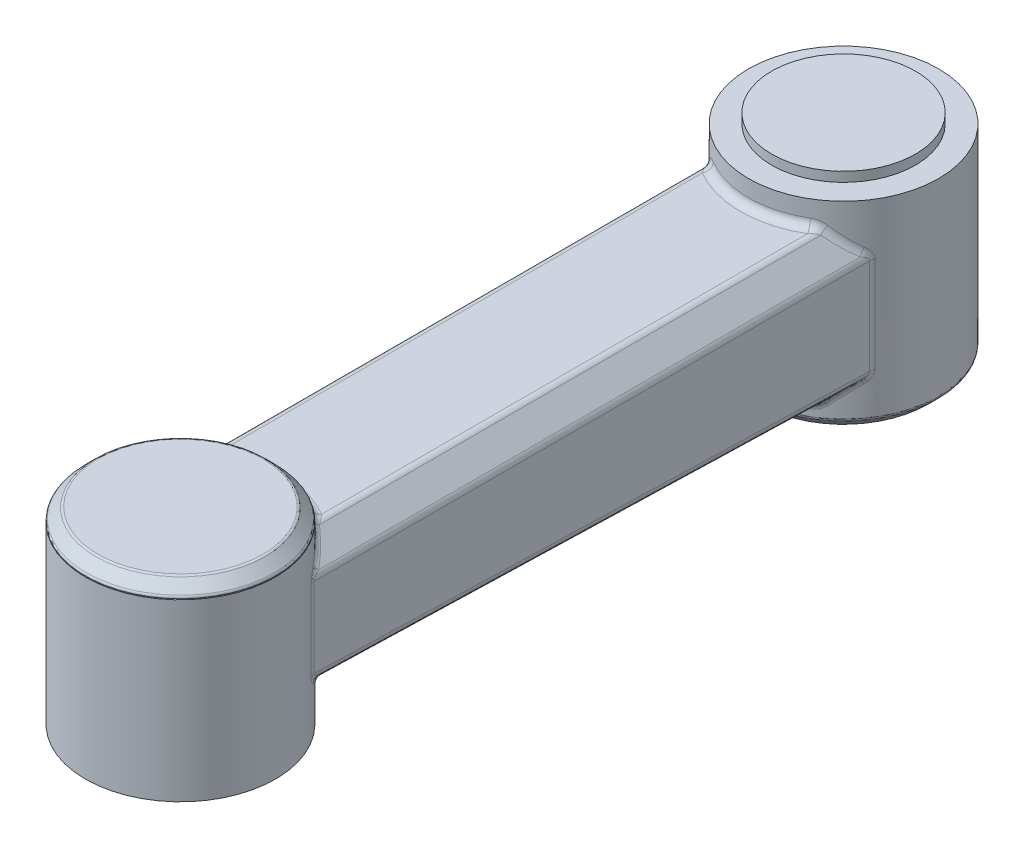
SolidWorks part; units mm, degrees
ref_plane "Ön Düzlem" through (0, 0, 0) normal (0, 0, 1) x (1, 0, 0)
ref_plane "Üst Düzlem" through (0, 0, 0) normal (0, 1, 0) x (1, 0, 0)
ref_plane "Sağ Düzlem" through (0, 0, 0) normal (1, 0, 0) x (0, 0, -1)
sketch "Çizim1" plane through (0, 0, 0) normal (1, 0, 0) x (0, 0, -1)
  line L1 (0, 0) -> (-59.5, 0)
  line L2 (0, 0) -> (0, 110)
  line L3 (0, 110) -> (-59.5, 110)
  line L4 (-59.5, 0) -> (-59.5, 110)
  line L5 (0, 0) -> (-45, 0)
  dimension "D1" = 59.5
  dimension "D2" = 110
revolve "Döndür1" add sketch "Çizim1" angle 360 about L2
sketch "Çizim2" plane through (0, 110, 0) normal (0, 1, 0) x (1, 0, 0)
  circle A0 centre (0, 0) radius 59.5
extrude "Yükseklik-Ekstrüzyon1" add sketch "Çizim2" along normal blind 8 separate body
chamfer "Pah1" distance 0.5 angle 45 1 edges at (0, 110, -59.5)
chamfer "Pah2" distance 7 angle 45 1 edges at (0, 118, 59.5)
fillet "Radyus1" radius 2 2 edges at (0, 111, 59.5) (0, 118, 52.5)
sketch "Çizim3" plane through (0, 0, 0) normal (0, 0, 1) x (1, 0, 0)
  line L0 (0, 110.1716) -> (0, 0) construction
  line L1 (-59.5, 110.1716) -> (59.5, 110.1716) construction
  line L3 (50, 7.5858) -> (-50, 7.5858)
  line L4 (50, 7.5858) -> (50, 102.5858)
  line L5 (50, 102.5858) -> (-50, 102.5858)
  line L6 (-50, 7.5858) -> (-50, 102.5858)
  line L7 (50, 7.5858) -> (-50, 102.5858) construction
  line L8 (50, 102.5858) -> (-50, 7.5858) construction
  point P5 (0, 55.0858)
  dimension "D1" = 95
  dimension "D2" = 100
ref_plane "Düzlem1" through (0, 0, 400) normal (0, 0, 1) x (1, 0, 0)
sketch "Çizim4" plane through (0, 0, 400) normal (0, 0, 1) x (1, 0, 0)
  line L0 (50, 7.5858) -> (-50, 102.5858) construction
  line L2 (50, 19.1687) -> (50, 102.5858)
  line L3 (50, 102.5858) -> (-50, 102.5858)
  line L4 (-50, 19.1687) -> (-50, 102.5858)
  line L5 (37.8075, 19.1687) -> (-50, 102.5858) construction
  line L6 (50, 102.5858) -> (-37.8075, 19.1687) construction
  line L7 (-50, 19.1687) -> (50, 19.1687)
  point P0 (0, 55.0858)
  dimension "D1" = 100
loft "Loft1" add profiles "Çizim4", "Çizim3"
ref_plane "Düzlem2" through (0, 0, 207.5) normal (0, 0, 1) x (1, 0, 0)
mirror "Aynalama1" about plane through (0, 0, 207.5) normal (0, 0, 1) of "Pah2", "Yükseklik-Ekstrüzyon1", "Döndür1", "Pah1", "Radyus1"
mirror "Aynalama3" about plane through (0, 0, 207.5) normal (0, 0, 1)
chamfer "Pah3" distance 15 angle 45 4 edges
fillet "Radyus2" radius 5 24 edges at (43.2339, 26.6566, 374.1211) (43.2339, 17.0069, 40.8789) (43.2339, 94.3519, 40.8789) (43.2339, 94.3519, 374.1211) (50, 87.5858, 207.5) (50, 55.5559, 32.2529) (50, 28.6007, 207.5) (50, 60.6306, 382.7471) (0, 17.8801, 355.5) (35, 13.5944, 207.5) (0, 9.3087, 59.5) (-35, 13.5944, 207.5) (-43.2339, 17.0069, 40.8789) (-43.2339, 26.6566, 374.1211) (-50, 28.6007, 207.5) (-50, 55.5559, 32.2529) (-50, 60.6306, 382.7471) (-50, 87.5858, 207.5) (-43.2339, 94.3519, 40.8789) (-43.2339, 94.3519, 374.1211) (-35, 102.5858, 207.5) (0, 102.5858, 59.5) (35, 102.5858, 207.5) (0, 102.5858, 355.5)
ref_plane "Düzlem3" through (0, 55, 0) normal (0, -1, 0) x (-1, 0, 0)
mirror "Aynalama4" about plane through (0, 55, 0) normal (0, -1, 0)
ref_plane "Düzlem4" through (0, 55, 0) normal (0, -1, 0) x (-1, 0, 0)
sketch "Çizim5" plane through (0, 118, 0) normal (0, 1, 0) x (1, 0, 0)
  circle A0 centre (0, 0) radius 59.5
  circle A1 centre (0, -415) radius 59.5
  dimension "D1" = 119
extrude "Yükseklik-Ekstrüzyon2" add sketch "Çizim5" against normal blind 10 contours M1 | A0 M1
sketch "Çizim6" plane through (0, 118, 0) normal (0, 1, 0) x (1, 0, 0)
  circle A0 centre (0, 0) radius 45
extrude "Yükseklik-Ekstrüzyon3" add sketch "Çizim6" along normal blind 6
sketch "Çizim7" plane through (0, 0, 0) normal (0, -1, 0) x (1, 0, 0)
  circle A0 centre (0, 415) radius 45
extrude "Kes-Ekstrüzyon1" cut sketch "Çizim7" against normal blind 5
